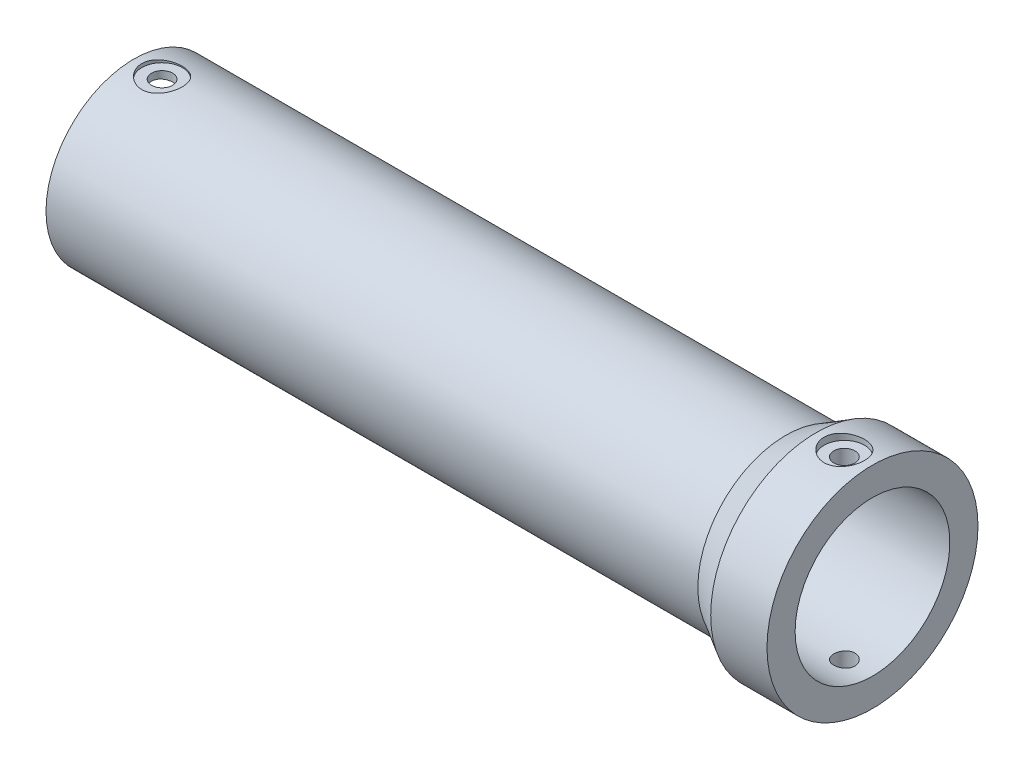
SolidWorks part; units mm, degrees
ref_plane "Plane1" through (0, 0, 0) normal (0, 0, 1) x (1, 0, 0)
ref_plane "Plane2" through (0, 0, 0) normal (0, 1, 0) x (1, 0, 0)
ref_plane "Plane3" through (0, 0, 0) normal (1, 0, 0) x (0, 0, -1)
sketch "Sketch1" plane through (0, 0, 0) normal (0, 0, 1) x (1, 0, 0)
  line L0 (0, 0) -> (108, 0) construction
  line L1 (0, 11) -> (48, 11)
  line L2 (48, 4.5) -> (50, 4.5)
  line L3 (48, 4.5) -> (48, 11)
  line L4 (105, 11) -> (105, 15)
  line L5 (105, 15) -> (97, 15)
  line L6 (0, 12.5) -> (0, 11)
  line L7 (50, 4.5) -> (50, 11)
  line L8 (50, 11) -> (105, 11)
  line L9 (97, 15) -> (92.6699, 12.5)
  line L10 (92.6699, 12.5) -> (0, 12.5)
  dimension "D1" = 11
  dimension "D2" = 30
  dimension "D3" = 55
  dimension "D4" = 2
  dimension "D5" = 105
  dimension "D6" = 4.5
  dimension "D7" = 12.5
  dimension "D8" = 30
  dimension "D9" = 8
revolve "Base-Revolve" add sketch "Sketch1" angle 360 about L0
ref_plane "Plane4" through (0, 15, 0) normal (0, 1, 0) x (-1, 0, 0)
sketch "Sketch2" plane through (0, 15, 0) normal (0, 1, 0) x (-1, 0, 0)
  line L0 (-105, 15) -> (-105, -15) construction
  circle A0 centre (-101, 0) radius 1.5
  dimension "D2" = 3
  dimension "D1" = 4
extrude "Cut-Extrude1" cut sketch "Sketch2" against normal blind 12
sketch "Sketch4" plane through (0, 15, 0) normal (0, 1, 0) x (-1, 0, 0)
  circle A0 centre (-101, 0) radius 2.875
  dimension "D1" = 5.75
extrude "Cut-Extrude3" cut sketch "Sketch4" against normal blind 1
pattern_circular "CirPattern1" count 2 over 360 about axis through (0, 0, 0) along (1, 0, 0) of "Cut-Extrude3", "Cut-Extrude1"
sketch "Sketch7" plane through (0, 15, 0) normal (0, 1, 0) x (-1, 0, 0)
  line L1 (0, 0) -> (-108, 0) construction
  circle A0 centre (-4, 0) radius 1.5
  dimension "D2" = 3
  dimension "D1" = 4
extrude "Cut-Extrude6" cut sketch "Sketch7" against normal blind 10
pattern_circular "CirPattern3" count 2 over 360 about axis through (4, 0, 0) along (0, 1, 0) of "Cut-Extrude6"
ref_plane "Plane5" through (0, 12.5, 0) normal (0, 1, 0) x (-1, 0, 0)
sketch "Sketch8" plane through (0, 12.5, 0) normal (0, 1, 0) x (-1, 0, 0)
  circle A0 centre (-4, 0) radius 2.875
  dimension "D1" = 5.75
extrude "Cut-Extrude7" cut sketch "Sketch8" against normal blind 0.5
pattern_circular "CirPattern4" count 2 over 360 about axis through (0, 0, 0) along (1, 0, 0) of "Cut-Extrude7"
sketch "Sketch9" plane through (50, 0, 0) normal (1, 0, 0) x (0, 0, -1)
  circle A0 centre (0, 7) radius 1.35
  dimension "D2" = 2.7
  dimension "D1" = 7
extrude "Cut-Extrude8" cut sketch "Sketch9" against normal blind 10
pattern_circular "CirPattern5" count 3 over 360 about axis through (0, 0, 0) along (1, 0, 0) of "Cut-Extrude8"
